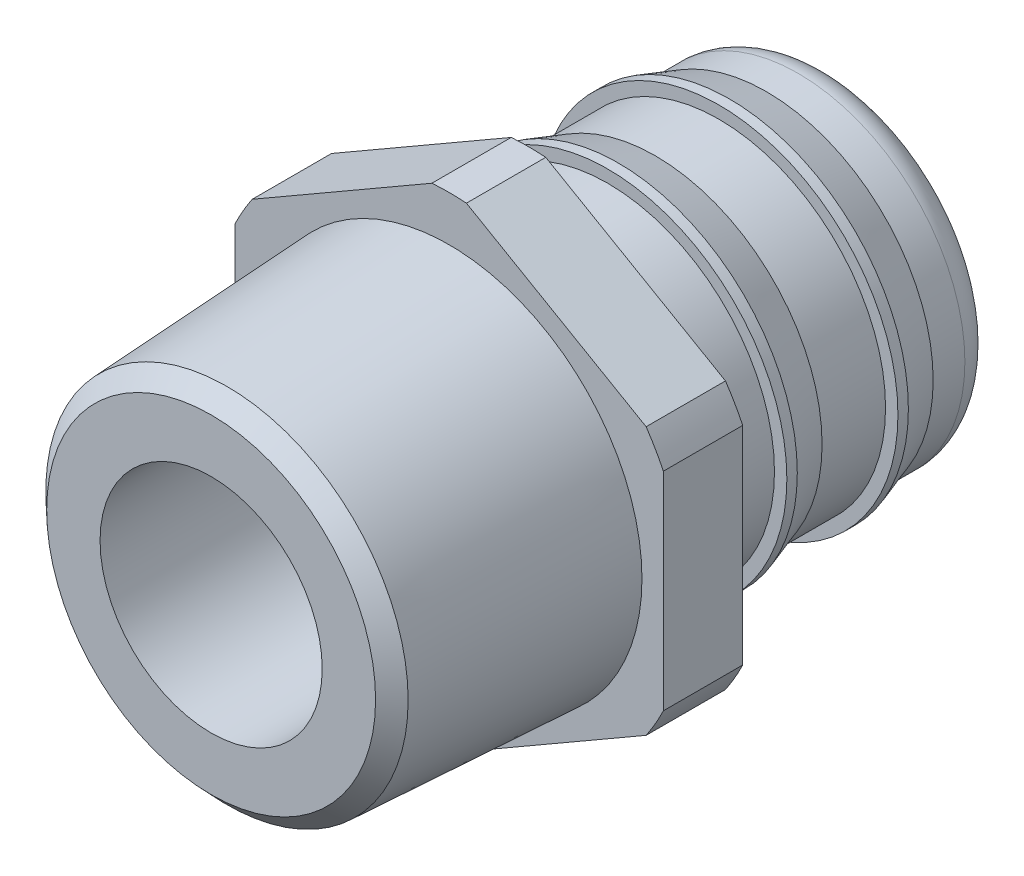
SolidWorks part; units mm, degrees
ref_plane "Plan de face" through (0, 0, 0) normal (0, 0, 1) x (1, 0, 0)
ref_plane "Plan de dessus" through (0, 0, 0) normal (0, 1, 0) x (1, 0, 0)
ref_plane "Plan de droite" through (0, 0, 0) normal (1, 0, 0) x (0, 0, -1)
sketch "Esquisse1" plane through (0, 0, 0) normal (1, 0, 0) x (0, 0, -1)
  line L0 (0, 0) -> (49, 0) construction
  line L1 (10, 7) -> (10, 10.3639)
  line L2 (42.6581, 11.2806) -> (42, 11.2806)
  line L3 (25, 12.15) -> (25, 15)
  line L4 (25, 15) -> (30, 15)
  line L5 (30, 15) -> (30, 10.5)
  line L6 (30, 10.5) -> (35, 10.5)
  line L7 (35, 10.5) -> (35, 11.2806)
  line L8 (35.6581, 11.2806) -> (38, 10.5)
  line L9 (38, 10.5) -> (42, 10.5)
  line L10 (42, 10.5) -> (42, 11.2806)
  line L11 (42.6581, 11.2806) -> (45, 10.5)
  line L12 (45, 10.5) -> (47, 10.5)
  line L13 (49, 8.5) -> (49, 7)
  line L15 (10.9986, 11.4162) -> (25, 12.15)
  line L16 (10, 10.3639) -> (10.9986, 11.4162)
  line L17 (10, 7) -> (49, 7)
  line L18 (35.6581, 11.2806) -> (35, 11.2806)
  arc A0 (49, 8.5) -> (47, 10.5) centre (47, 8.5) ccw
  point P5 (10, 11.3639)
  dimension "D16" = 2
  dimension "D17" = 0.6581
  dimension "D1" = 15
  dimension "D3" = 5
  dimension "D4" = 12
  dimension "D5" = 19
  dimension "D6" = 24.3
  dimension "D8" = 21
  dimension "D9" = 3
  dimension "D11" = 5
  dimension "D12" = 30
  dimension "D13" = 22.5613
  dimension "D14" = 10
  dimension "D15" = 1
  dimension "D19" = 8
  dimension "D23" = 14
  dimension "D18" = 0.6581
revolve "Révolution1" add sketch "Esquisse1" angle 360 about L0
sketch "Esquisse2" plane through (0, 0, -30) normal (0, 0, -1) x (-1, 0, 0)
  line L1 (13.5, -6.5383) -> (13.5, 6.5383)
  line L2 (12.4124, 8.4222) -> (1.0876, 14.9605)
  line L3 (-1.0876, 14.9605) -> (-12.4124, 8.4222)
  line L4 (-13.5, 6.5383) -> (-13.5, -6.5383)
  line L5 (-12.4124, -8.4222) -> (-1.0876, -14.9605)
  line L6 (1.0876, -14.9605) -> (12.4124, -8.4222)
  circle A0 centre (0, 0) radius 13.5 construction
  circle A1 centre (0, 0) radius 15 construction
  arc A2 (-1.0876, 14.9605) -> (-12.4124, 8.4222) centre (0, 0) ccw
  arc A3 (-13.5, 6.5383) -> (-13.5, -6.5383) centre (0, 0) ccw
  arc A4 (-12.4124, -8.4222) -> (-1.0876, -14.9605) centre (0, 0) ccw
  arc A5 (1.0876, -14.9605) -> (12.4124, -8.4222) centre (0, 0) ccw
  arc A6 (13.5, -6.5383) -> (13.5, 6.5383) centre (0, 0) ccw
  arc A7 (12.4124, 8.4222) -> (1.0876, 14.9605) centre (0, 0) ccw
  dimension "D1" = 27
extrude "Enlèv. mat.-Extru.1" cut sketch "Esquisse2" against normal through all
